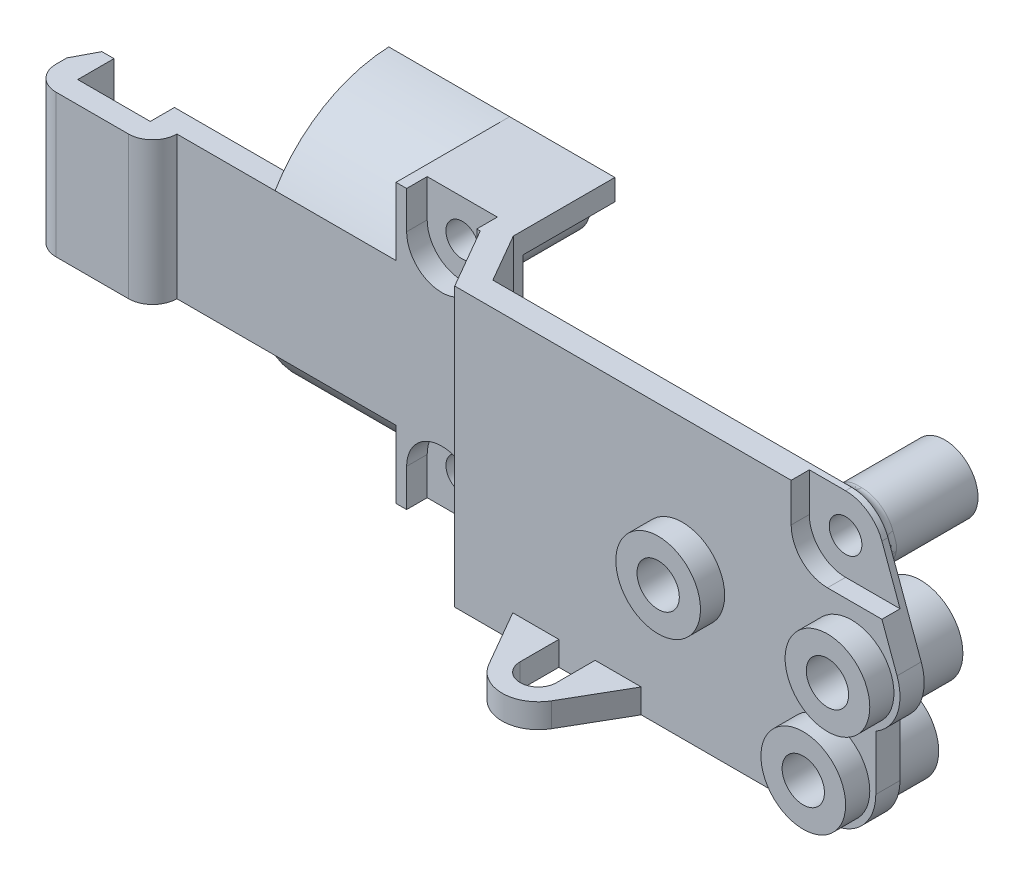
SolidWorks part; units mm, degrees
ref_plane "Front Plane" through (0, 0, 0) normal (0, 0, 1) x (1, 0, 0)
ref_plane "Top Plane" through (0, 0, 0) normal (0, 1, 0) x (1, 0, 0)
ref_plane "Right Plane" through (0, 0, 0) normal (1, 0, 0) x (0, 0, -1)
sketch "Sketch1" plane through (0, 0, 0) normal (0, 0, 1) x (1, 0, 0)
  line L0 (-4.567, -11.8) -> (25.103, -11.8)
  line L1 (29.103, -7.8) -> (29.103, -3.2641)
  line L2 (28.1084, 9.0988) -> (30.8598, 1.5735)
  line L3 (25.103, 11.2) -> (-4.567, 11.2)
  line L4 (29.103, -7.8) -> (29.103, -3.2641) construction
  line L9 (999.5524, 0.2) -> (-4.567, 0.2) construction
  line L10 (-4.567, 11.2) -> (-4.567, -11.8)
  arc A0 (29.103, -3.2641) -> (30.8598, 1.5735) centre (27.103, 0.2) ccw
  circle A2 centre (-0.897, 0.2) radius 1.5
  circle A3 centre (13.103, 0.2) radius 1.75
  circle A4 centre (27.103, 0.2) radius 1.75
  circle A5 centre (25.103, -7.8) radius 1.75
  arc A6 (25.103, -11.8) -> (29.103, -7.8) centre (25.103, -7.8) ccw
  circle A7 centre (25.103, 8) radius 1.35
  arc A9 (25.103, 11.2) -> (28.1084, 9.0988) centre (25.103, 8) cw
  circle A12 centre (-0.897, 0.2) radius 1.5 construction
  point P0 (31.103, 0.2)
  dimension "D9" = 3.5
  dimension "D10" = 3.5
  dimension "D11" = 3
  dimension "D12" = 3.5
  dimension "D13" = 2.7
  dimension "D14" = 4
  dimension "D15" = 3.2
  dimension "D19" = 4
  dimension "D3" = 35.67
  dimension "D4" = 14
  dimension "D7" = 12
  dimension "D8" = 2
  dimension "D18" = 23
  dimension "D20" = 8
  dimension "D21" = 7.8
extrude "Boss-Extrude1" add sketch "Sketch1" along normal blind 2 contours L10 L0 A6 L1 A0 L2 A9 L3 | A3 | A7 | A4 | A5
ref_plane "Plane1" through (0, -0.3, 0) normal (0, 1, 0) x (-1, 0, 0)
sketch "Sketch4" plane through (0, 0, 0) normal (0, 0, 1) x (1, 0, 0)
  circle A0 centre (27.103, 0.2) radius 3.5
  circle A1 centre (27.103, 0.2) radius 1.75 construction
  circle A2 centre (27.103, 0.2) radius 1.75
  circle A3 centre (25.103, -7.8) radius 1.75 construction
  circle A4 centre (25.103, -7.8) radius 1.75
  circle A5 centre (25.103, -7.8) radius 3.5
  dimension "D1" = 7
extrude "Boss-Extrude3" add sketch "Sketch4" against normal offset from surface (3.7 mm away) 3.7
sketch "Sketch3" plane through (0, 0, 2) normal (0, 0, -1) x (-1, 0, 0)
  circle A0 centre (-25.103, -7.8) radius 3.5
  circle A1 centre (-25.103, -7.8) radius 1.75 construction
  circle A2 centre (-25.103, -7.8) radius 1.75
  circle A3 centre (-27.103, 0.2) radius 1.75 construction
  circle A4 centre (-13.103, 0.2) radius 1.75 construction
  circle A5 centre (-27.103, 0.2) radius 1.75
  circle A6 centre (-13.103, 0.2) radius 1.75
  circle A7 centre (-27.103, 0.2) radius 3.5
  circle A8 centre (-13.103, 0.2) radius 3.5
  dimension "D1" = 7
extrude "Boss-Extrude4" add sketch "Sketch3" against normal offset from surface (2 mm away) 7.7
sketch "Sketch5" plane through (0, -0.3, 0) normal (0, 1, 0) x (1, 0, 0)
  line L0 (-4.567, -2) -> (-4.567, 0) construction
  line L8 (29.9414, -1) -> (13.8394, -1) construction
  line L17 (25.103, 0) -> (-4.567, 0) construction
  line L18 (25.103, -2) -> (-4.567, -2) construction
  line L19 (-5.7217, -2) -> (-8.6085, 3)
  line L20 (-6.8764, 4) -> (-4.567, 0)
  line L21 (-4.567, 0) -> (-4.567, -2)
  line L22 (-4.567, -2) -> (-5.7217, -2)
  line L23 (-33.697, 3) -> (-8.6085, 3)
  line L24 (-33.697, 1) -> (-33.697, 3)
  line L25 (-43.697, 1) -> (-33.697, 1)
  line L26 (-43.697, 3.9) -> (-43.697, 1)
  line L27 (-42.697, 5.8) -> (-43.697, 3.9)
  line L28 (-41.697, 5.8) -> (-42.697, 5.8)
  line L29 (-41.697, 2.8) -> (-41.697, 5.8)
  line L30 (-35.697, 2.8) -> (-41.697, 2.8)
  line L31 (-35.697, 4.8) -> (-35.697, 2.8)
  line L32 (-6.8764, 4.8) -> (-35.697, 4.8)
  line L33 (-6.8764, 4.8) -> (-6.8764, 4)
  dimension "D1" = 120
  dimension "D2" = 1.8
  dimension "D3" = 1.9
  dimension "D4" = 1
  dimension "D5" = 1.8
  dimension "D6" = 5
  dimension "D7" = 2
  dimension "D8" = 2
  dimension "D9" = 1
  dimension "D10" = 2
  dimension "D11" = 2
  dimension "D12" = 8
  dimension "D13" = 1
  dimension "D14" = 34.8
extrude "Boss-Extrude5" add sketch "Sketch5" along normal mid plane 11.8
fillet "Fillet1" radius 2 2 edges at (-43.697, -0.3, -1) (-33.697, -0.3, -1)
sketch "Sketch6" plane through (0, 0, 0) normal (0, 0, 1) x (1, 0, 0)
  circle A0 centre (25.103, 8) radius 1.35 construction
  circle A1 centre (25.103, 8) radius 1.35
  circle A2 centre (25.103, 8) radius 2.75
  dimension "D1" = 5.5
extrude "Boss-Extrude6" add sketch "Sketch6" against normal blind 7.7
sketch "Sketch8" plane through (0, 0, 0) normal (0, 0, 1) x (1, 0, 0)
  circle A0 centre (-0.897, 0.2) radius 3
  circle A1 centre (-0.897, 0.2) radius 1.5 construction
  circle A2 centre (-0.897, 0.2) radius 1.5
  dimension "D1" = 6
extrude "Boss-Extrude7" add sketch "Sketch8" against normal blind 2.65
sketch "Sketch9" plane through (0, -0.3, 0) normal (0, -1, 0) x (1, 0, 0)
  line L5 (-8.6085, -3) -> (-5.7217, 2) construction
  line L6 (-4.567, 0) -> (-6.8764, -4) construction
  line L7 (-6.8764, -4.8) -> (-35.697, -4.8) construction
  line L8 (-6.8764, -4) -> (-6.8764, -4.8) construction
  line L13 (-1.123, 1) -> (4.8741, 1) construction
  line L14 (-4.567, 0) -> (25.103, 0) construction
  line L15 (-4.567, 2) -> (25.103, 2) construction
  line L16 (-8.6085, -4.8) -> (-6.8764, -4.8)
  line L17 (-8.6085, -3) -> (-8.6085, -4.8)
  line L18 (-6.8764, -4.8) -> (-6.8764, -4)
  line L19 (-4.567, 0) -> (-4.567, 2)
  line L20 (-6.8764, -4) -> (-4.567, 0)
  line L21 (-4.567, 2) -> (-5.7217, 2)
  line L22 (-5.7217, 2) -> (-8.6085, -3)
extrude "Boss-Extrude10" add sketch "Sketch9" along normal mid plane 23
sketch "Sketch10" plane through (0, 0, -3) normal (0, 0, -1) x (-1, 0, 0)
  line L0 (25.5764, -11.8) -> (6.8764, -11.8)
  line L1 (6.8764, -11.8) -> (6.8764, -10.05)
  line L2 (6.8764, -10.05) -> (9.2304, -10.05)
  line L3 (12.9925, -6.0579) -> (14.597, -4.6025)
  line L4 (14.597, -4.6025) -> (14.597, 4.0025)
  line L5 (16.397, 4.8) -> (16.397, -5.4)
  line L6 (16.397, -5.4) -> (14.3251, -7.2792)
  line L7 (14.0708, -10.5) -> (25.5764, -10.5)
  line L8 (25.5764, -10.5) -> (25.5764, -11.8)
  line L9 (25.5764, 9.9) -> (25.5764, 11.2)
  line L10 (14.0708, 9.9) -> (25.5764, 9.9)
  line L11 (16.397, 4.8) -> (14.3251, 6.6792)
  line L12 (-8.6455, -0.3) -> (-5.3863, -0.3) construction
  line L13 (-25.103, 11.2) -> (5.7217, 11.2) construction
  line L14 (12.9925, 5.4579) -> (14.597, 4.0025)
  line L15 (6.8764, 9.45) -> (9.2304, 9.45)
  line L16 (6.8764, 11.2) -> (6.8764, 9.45)
  line L17 (25.5764, 11.2) -> (6.8764, 11.2)
  line L18 (6.8764, 11.2) -> (6.8764, -11.8) construction
  line L19 (6.8764, 11.2) -> (6.8764, -11.8) construction
  line L22 (5.7217, -11.8) -> (-25.103, -11.8) construction
  line L25 (16.397, 4.8) -> (16.397, 2.7) construction
  line L26 (-25.103, 11.2) -> (4.567, 11.2) construction
  arc A0 (9.2304, -10.05) -> (12.9925, -6.0579) centre (11.797, -8.7) cw
  arc A1 (14.3251, -7.2792) -> (14.0708, -10.5) centre (11.797, -8.7) cw
  arc A2 (14.3251, 6.6792) -> (14.0708, 9.9) centre (11.797, 8.1) ccw
  arc A3 (9.2304, 9.45) -> (12.9925, 5.4579) centre (11.797, 8.1) ccw
  circle A4 centre (11.797, 8.1) radius 1.35
  circle A5 centre (11.797, -8.7) radius 1.35
  dimension "D1" = 2.9
  dimension "D14" = 2.7
  dimension "D11" = 10.9
  dimension "D2" = 1.3
  dimension "D3" = 1.8
  dimension "D4" = 18.7
  dimension "D5" = 1.8
  dimension "D6" = 10.2
  dimension "D7" = 1.3
  dimension "D8" = 1.75
  dimension "D9" = 3.1
  dimension "D10" = 3.1
  dimension "D12" = 1.8
extrude "Boss-Extrude11" add sketch "Sketch10" along normal offset from surface (9.4 mm away) 9.4
sketch "Sketch11" plane through (0, 0, -3) normal (0, 0, -1) x (-1, 0, 0)
  line L0 (25.5764, 11.2) -> (8.6085, 11.2) construction
  line L1 (8.6085, -11.8) -> (17.0924, -11.8)
  line L2 (8.6085, -11.8) -> (8.6085, 11.2)
  line L3 (8.6085, 11.2) -> (17.0924, 11.2)
  line L4 (17.0924, -11.8) -> (17.0924, 11.2)
  line L6 (8.6085, 5.6) -> (8.6085, -6.2) construction
  line L7 (8.6085, -11.8) -> (25.5764, -11.8) construction
  circle A0 centre (11.797, 8.1) radius 1.35 construction
  circle A1 centre (11.797, -8.7) radius 1.35 construction
  circle A2 centre (11.797, 8.1) radius 1.35
  circle A3 centre (11.797, -8.7) radius 1.35
extrude "Boss-Extrude12" add sketch "Sketch11" along normal up to surface (1.8 mm away)
sketch "Sketch13" plane through (0, 0, 2) normal (0, 0, -1) x (-1, 0, 0)
  line L0 (-29.607, 5) -> (-25.103, 5)
  line L1 (-28.1084, 9.0988) -> (-30.8598, 1.5735) construction
  line L2 (-22.103, 8) -> (-22.103, 11.2)
  line L3 (-25.103, 11.2) -> (4.567, 11.2) construction
  line L4 (-28.1084, 9.0988) -> (-29.607, 5)
  line L5 (-25.103, 11.2) -> (-22.103, 11.2)
  arc A0 (-25.103, 5) -> (-22.103, 8) centre (-25.103, 8) ccw
  circle A1 centre (-25.103, 8) radius 1.35 construction
  arc A2 (-25.103, 11.2) -> (-28.1084, 9.0988) centre (-25.103, 8) ccw construction
  arc A3 (-25.103, 11.2) -> (-28.1084, 9.0988) centre (-25.103, 8) ccw
  dimension "D1" = 3
extrude "Cut-Extrude3" cut sketch "Sketch13" along normal blind 1.5
fillet "Fillet2" radius 1 1 edges at (27.853, 8, 0)
sketch "Sketch14" plane through (-25.5764, 0, 0) normal (-1, 0, 0) x (0, 0, 1)
  line L1 (-12.4, 3.4085) -> (-12.4, -5.8) construction
  line L4 (-12.4, -10.5) -> (-12.4, -11.8)
  line L5 (-4.8, -6.2) -> (-3, -6.2)
  line L6 (-12.4, -5.4) -> (-12.4, 4.8) construction
  line L7 (-4.8, -6.2) -> (-2.8, -6.2) construction
  line L8 (-12.4, -10.5) -> (-3, -10.5) construction
  line L9 (-12.4, -11.8) -> (-3, -11.8) construction
  arc A0 (-12.4, -10.5) -> (-4.8, -6.2) centre (-13.0302, -0.5199) ccw
  arc A1 (-12.4, -11.8) -> (-3, -6.2) centre (-12.8771, -0.3099) ccw
  dimension "D1" = 10
  dimension "D2" = 11.5
sketch "Sketch23" plane through (-25.5764, 0, -25.5764) normal (1, 0, 0) x (0, 0, -1)
  line L1 (-14.9764, -1001.8209) -> (-14.9764, 48998.1791) construction
  line L3 (-13.1764, 9.9) -> (-13.1764, 11.2)
  line L4 (-20.7764, 5.6) -> (-22.5764, 5.6)
  arc A0 (-13.1764, 9.9) -> (-20.7764, 5.6) centre (-12.5462, -0.0801) ccw
  arc A1 (-13.1764, 11.2) -> (-22.5764, 5.6) centre (-12.6993, -0.2901) ccw
  dimension "D1" = 10
  dimension "D2" = 11.5
extrude "Boss-Extrude20" add sketch "Sketch14" against normal up to body
extrude "Boss-Extrude19" add sketch "Sketch23" along normal up to body
sketch "Sketch12" plane through (0, 0, -3) normal (0, 0, -1) x (-1, 0, 0)
  line L0 (8.897, -11.8) -> (8.897, -8.7)
  line L1 (8.6085, -11.8) -> (25.5764, -11.8) construction
  line L2 (14.697, -8.7) -> (14.697, -11.8)
  line L3 (14.697, -11.8) -> (8.897, -11.8)
  arc A0 (8.897, -8.7) -> (14.697, -8.7) centre (11.797, -8.7) cw
  arc A1 (12.9925, -6.0579) -> (9.2304, -10.05) centre (11.797, -8.7) ccw construction
extrude "Cut-Extrude1" cut sketch "Sketch12" along normal blind 1.7
mirror "Mirror1" about plane through (0, -0.3, 0) normal (0, 1, 0) of "Cut-Extrude1"
sketch "Sketch17" plane through (0, 0, -3) normal (0, 0, -1) x (-1, 0, 0)
  line L0 (15.197, 11.2) -> (15.197, 6.7766)
  line L1 (25.5764, 11.2) -> (14.697, 11.2) construction
  line L2 (15.197, 6.7766) -> (16.197, 6.7766)
  line L3 (16.197, 6.7766) -> (16.197, 11.2)
  line L4 (15.197, 11.2) -> (16.197, 11.2)
  line L5 (14.697, 11.2) -> (14.697, 8.1) construction
  dimension "D1" = 0.5
  dimension "D2" = 1
extrude "Boss-Extrude21" add sketch "Sketch17" along normal up to next
sketch "Sketch18" plane through (-25.5764, 0, 0) normal (-1, 0, 0) x (0, 0, 1)
  line L0 (-12.4, 11.2) -> (-3, 11.2) construction
  line L3 (-12.4, 11.2) -> (-3, 11.2)
  line L4 (-3, 11.2) -> (-3, 5.6)
  arc A0 (-12.4, 11.2) -> (-3, 5.6) centre (-12.8771, -0.2901) cw
  arc A1 (-3, 5.6) -> (-7.5468, 9.9) centre (-12.8771, -0.2901) ccw construction
extrude "Cut-Extrude5" cut sketch "Sketch18" against normal blind 10
sketch "Sketch19" plane through (0, 0, -3) normal (0, 0, -1) x (-1, 0, 0)
  line L0 (14.697, -11.8) -> (25.5764, -11.8) construction
  line L1 (15.197, -11.8) -> (16.697, -11.8)
  line L2 (15.197, -11.8) -> (15.197, -5.8923)
  line L3 (15.197, -5.8923) -> (16.697, -5.8923)
  line L4 (16.697, -11.8) -> (16.697, -5.8923)
  line L6 (14.697, -11.8) -> (14.697, -8.7) construction
  point P6 (14.697, -10.25)
  dimension "D1" = 0.5
  dimension "D2" = 1.5
extrude "Boss-Extrude22" add sketch "Sketch19" along normal up to surface (9.4 mm away)
mirror "Mirror2" about plane through (0, -0.3, 0) normal (0, 1, 0) of "Cut-Extrude5"
sketch "Sketch21" plane through (-16.397, 0, 0) normal (-1, 0, 0) x (0, 0, 1)
  line L0 (-12.4, 4.8) -> (-12.4, -5.4) construction
  circle A0 centre (-12.4, -0.3) radius 3
  dimension "D1" = 6
extrude "Cut-Extrude7" cut sketch "Sketch21" against normal up to next
sketch "Sketch22" plane through (0, -11.8, 0) normal (0, -1, 0) x (1, 0, 0)
  line L8 (18.5687, 1) -> (14.3563, 1) construction
  line L9 (-5.7217, 2) -> (25.103, 2) construction
  line L10 (-4.567, 0) -> (25.103, 0) construction
  line L11 (5.8915, 2) -> (5.8915, 5.2)
  line L12 (5.8915, 2) -> (9.7032, 2)
  line L13 (2.8915, 5.2) -> (2.8915, 2)
  line L14 (-0.9201, 2) -> (2.8915, 2)
  line L15 (6.9896, 6.7) -> (9.7032, 2)
  line L16 (-0.9201, 2) -> (1.7935, 6.7)
  arc A2 (2.8915, 5.2) -> (5.8915, 5.2) centre (4.3915, 5.2) cw
  arc A3 (1.7935, 6.7) -> (6.9896, 6.7) centre (4.3915, 5.2) cw
  point P39 (4.3915, 8.2)
  dimension "D2" = 1.5
  dimension "D3" = 3
  dimension "D5" = 120
  dimension "D1" = 13
  dimension "D4" = 120
  dimension "D6" = 6.2
extrude "Boss-Extrude17" add sketch "Sketch22" against normal blind 2
